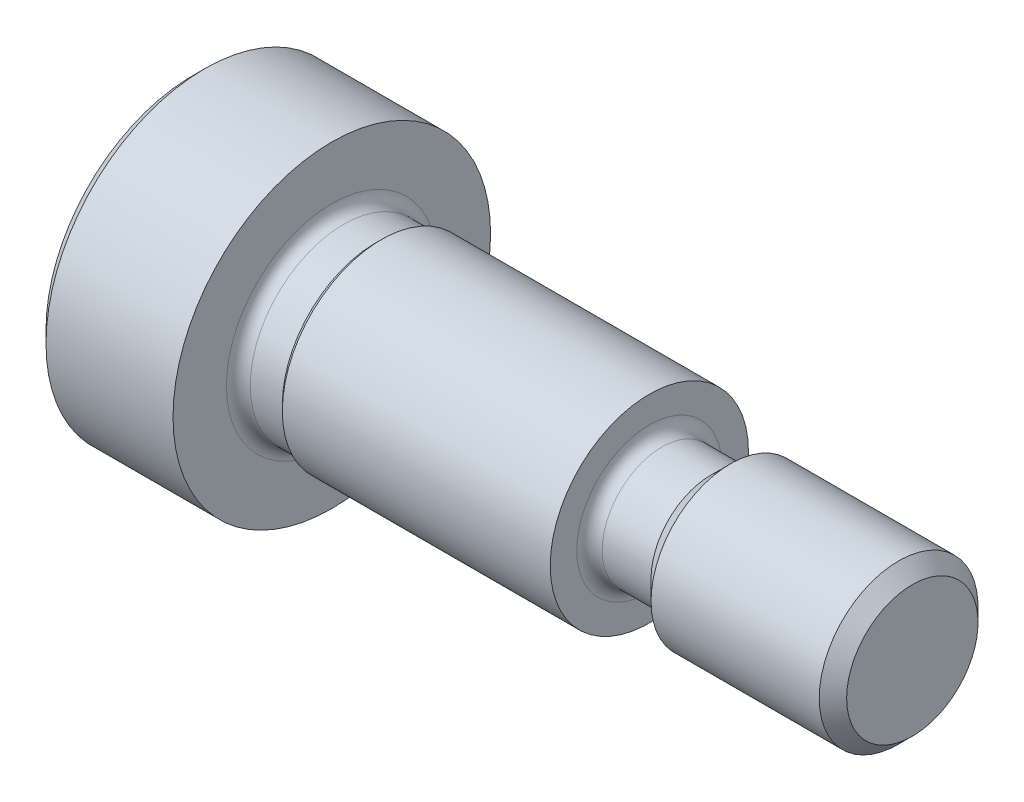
SolidWorks part; units mm, degrees
ref_plane "Plane1" through (0, 0, 0) normal (0, 0, 1) x (1, 0, 0)
ref_plane "Plane2" through (0, 0, 0) normal (0, 1, 0) x (1, 0, 0)
ref_plane "Plane3" through (0, 0, 0) normal (1, 0, 0) x (0, 0, -1)
sketch "BodySke" plane through (0, 0, 0) normal (0, 0, 1) x (1, 0, 0)
  line L0 (0, 0) -> (0, 8)
  line L2 (0, 8) -> (7, 8)
  line L3 (7, 8) -> (7, 5.31)
  line L4 (7.6, 4.71) -> (9.2165, 4.71)
  line L5 (9.2165, 4.71) -> (9.5, 4.9935)
  line L6 (9.5, 4.9935) -> (23, 4.9935)
  line L7 (23, 4.9935) -> (23, 3.655)
  line L8 (23.64, 3.015) -> (26.1, 3.015)
  line L9 (26.1, 3.015) -> (27.085, 4)
  line L10 (27.085, 4) -> (35.5595, 4)
  line L11 (35.5595, 4) -> (36.25, 3.3095)
  line L12 (36.25, 3.3095) -> (36.25, 0)
  line L13 (36.25, 0) -> (0, 0)
  line L14 (-6.35, 0) -> (107.95, 0) construction
  line L15 (35.5595, -4) -> (36.25, -3.3095) construction
  line L16 (23, -3.015) -> (26.1, -3.015) construction
  line L17 (9.5, -4.9935) -> (23, -4.9935) construction
  line L18 (7, -4.71) -> (9.2165, -4.71) construction
  line L20 (27.35, 7.8664) -> (27.35, -9.4864) construction
  line L21 (23, 7.0856) -> (23, -8.764) construction
  arc A0 (23, 3.655) -> (23.64, 3.015) centre (23.64, 3.655) ccw
  arc A1 (7.6, 4.71) -> (7, 5.31) centre (7.6, 5.31) cw
  point P29 (23, 3.015)
  point P32 (7, 4.71)
  dimension "Thread_neck_fillet_rad" = 0.64
  dimension "Head_fillet_radius" = 0.6
  dimension "Head_dia" = 16
  dimension "Head_ht" = 7
  dimension "Shoulder_neck_dia" = 9.42
  dimension "Diameter" = 9.987
  dimension "Thread_dia" = 8
  dimension "Minor_dia" = 6.619
  dimension "Thread_ch_ang" = 45
  dimension "Thread_neck_dia" = 6.03
  dimension "D11" = 45
  dimension "Thread_length" = 13.25
  dimension "D13" = 45
  dimension "Length" = 16
  dimension "Thread_neck_width" = 3.1
  dimension "Shoulder_neck_width" = 2.5
  dimension "Advance" = 1.25
  dimension "Thread_nom" = 13.25
  dimension "Thread_lim" = 8.9
revolve "BaseBody" add sketch "BodySke" angle 360 about L14
chamfer "Chamfer1" distance 0.6 1 edges at (0, 0, 8)
sketch "Sketch2" plane through (0, 0, 0) normal (0, 0, 1) x (1, 0, 0)
  line L0 (0, 2.5475) -> (4.2, 2.5475)
  line L1 (4.2, 2.5475) -> (5.6708, 0)
  line L3 (5.6708, 0) -> (0, 0)
  line L4 (0, 0) -> (0, 2.5475)
  line L5 (0, -2.5475) -> (4.2, -2.5475) construction
  line L6 (0, 0) -> (47.625, 0) construction
  dimension "D2" = 60
  dimension "PreBroach_depth" = 4.2
  dimension "PreBroach_dia" = 5.095
revolve "PreBroach" cut sketch "Sketch2" angle 360 about L6
sketch "Sketch3" plane through (0, 0, 0) normal (-1, 0, 0) x (0, 0, 1)
  line L0 (-2.5475, -1.4708) -> (-2.5475, 1.4708)
  line L1 (-2.5475, 1.4708) -> (0, 2.9416)
  line L2 (0, 2.9416) -> (2.5475, 1.4708)
  line L3 (2.5475, 1.4708) -> (2.5475, -1.4708)
  line L4 (2.5475, -1.4708) -> (0, -2.9416)
  line L5 (0, -2.9416) -> (-2.5475, -1.4708)
  dimension "D1" = 2.5475
  dimension "Hex_size" = 5.095
  dimension "D2" = 2.5475
  dimension "D3" = 120
  dimension "D4" = 5.095
extrude "Hex" cut sketch "Sketch3" against normal blind 4.2
sketch "ThdSchSke" plane through (0, 0, 0) normal (0, 0, 1) x (1, 0, 0)
  line L0 (27.35, -3.3095) -> (26.1709, -4.9935)
  line L1 (27.35, -3.3095) -> (28.5291, -4.9935)
  line L2 (28.5291, -4.9935) -> (28.5291, -6.2419)
  line L3 (-3.175, 0) -> (5.1513, 0) construction
  line L5 (28.5291, -6.2419) -> (26.1709, -6.2419)
  line L6 (26.1709, -6.2419) -> (26.1709, -4.9935)
  dimension "Thread_minor" = 6.619
  dimension "Diameter" = 9.987
  dimension "Start" = 27.35
  dimension "SideAngle" = 55
  dimension "VeeAngle" = 70
  dimension "Overcut" = 12.4838
revolve "ThreadSchematic" [suppressed] cut sketch "ThdSchSke" angle 360 about L3
pattern_linear "ThdSchPat" [suppressed]
equation "\"Thread_minor@ThreadCosmetic\" = \"Minor_dia@BodySke\""
equation "\"D1@Sketch3\" = \"Hex_size@Sketch3\" / 2"
equation "\"D2@Sketch3\" = \"D1@Sketch3\""
equation "\"D4@Sketch3\" = \"Hex_size@Sketch3\""
equation "\"Width@Chamfer1\" = \"Head_fillet_radius@BodySke\""
equation "\"Thread_length@ThreadCosmetic\" = ((sgn( (\"Thread_length@BodySke\" - \"Advance@BodySke\" - \"Thread_neck_width@BodySke\" ) - \"Thread_nom@BodySke\" )-1)*( (\"Thread_length@BodySke\" - \"Advance@BodySke\" - \"Threa"
equation "\"Thread_minor@ThdSchSke\" = \"Minor_dia@BodySke\""
equation "\"Diameter@ThdSchSke\" = \"Diameter@BodySke\""
equation "\"Overcut@ThdSchSke\" = \"Diameter@BodySke\" * 1.25"
equation "\"Start@ThdSchSke\" = \"Head_ht@BodySke\" + \"Length@BodySke\" + \"Thread_length@BodySke\" -  \"Thread_length@ThreadCosmetic\"  '---Non-countersunk---"
equation "\"Num_threads@ThdSchPat\" = int( \"Thread_length@ThreadCosmetic\" / \"Advance@BodySke\" + 0.999 ) + 1"
equation "\"Advance@ThdSchPat\" = \"Thread_length@ThreadCosmetic\" /  (\"Num_threads@ThdSchPat\" - 1) 'relax it"
equation "\"Num_threads@ThdSchPat\" = \"Num_threads@ThdSchPat\" - sgn( \"Num_threads@ThdSchPat\" - 1) '---chamfered tips only---"
